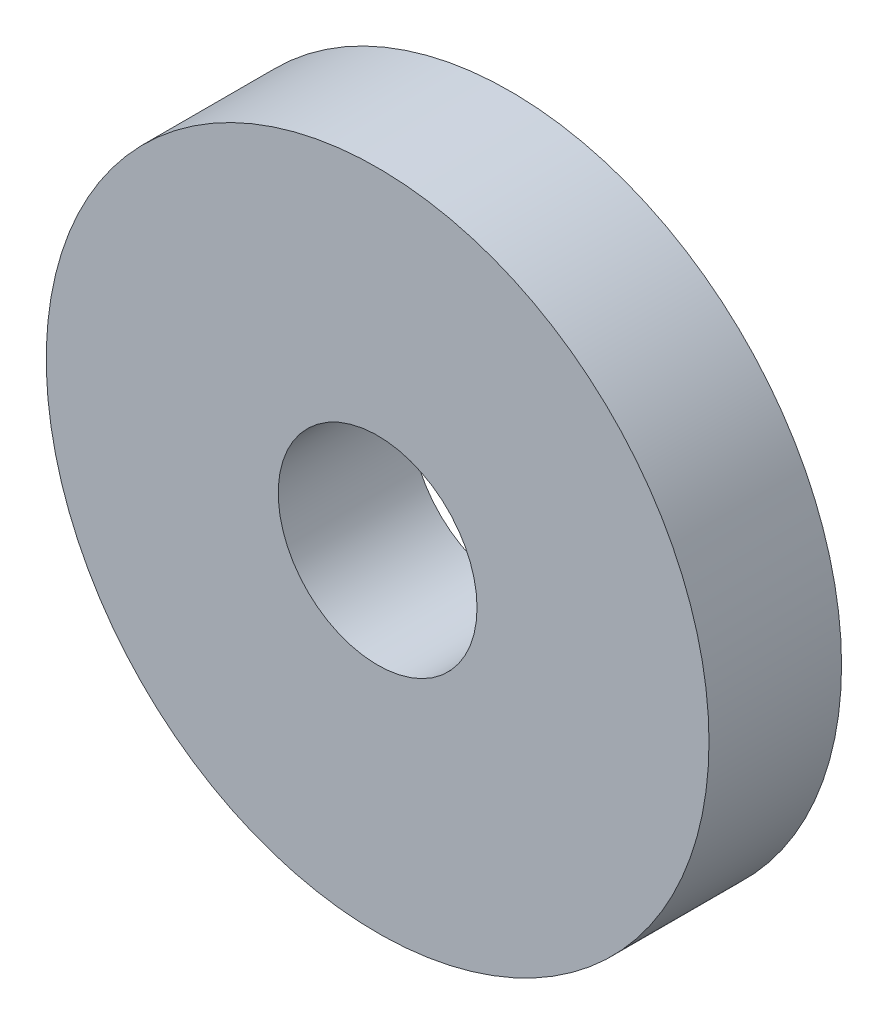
SolidWorks part; units mm, degrees
ref_plane "Face" through (0, 0, 0) normal (0, 0, 1) x (1, 0, 0)
ref_plane "Dessus" through (0, 0, 0) normal (0, 1, 0) x (1, 0, 0)
ref_plane "Droite" through (0, 0, 0) normal (1, 0, 0) x (0, 0, -1)
sketch "Esquisse1" plane through (0, 0, 0) normal (0, 0, 1) x (1, 0, 0)
  circle A0 centre (0, 0) radius 25
  circle A1 centre (0, 0) radius 7.5
  dimension "D1" = 15
  dimension "D2" = 50
extrude "Extrusion1" add sketch "Esquisse1" along normal blind 10
